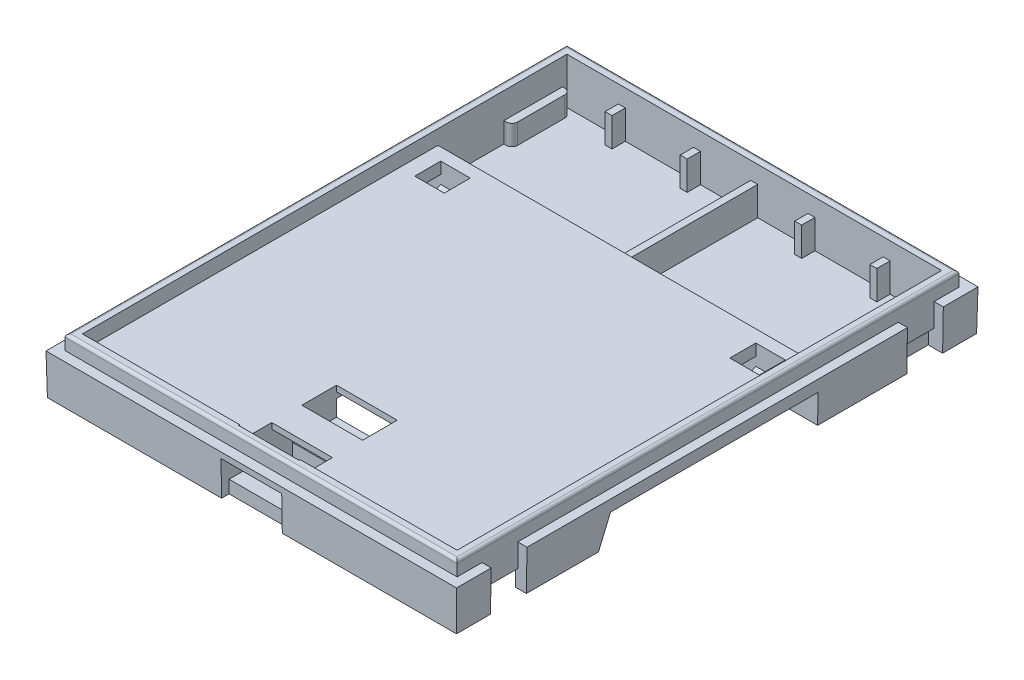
SolidWorks part; units mm, degrees
ref_plane "Спереди" through (0, 0, 0) normal (0, 0, 1) x (1, 0, 0)
ref_plane "Сверху" through (0, 0, 0) normal (0, 1, 0) x (1, 0, 0)
ref_plane "Справа" through (0, 0, 0) normal (1, 0, 0) x (0, 0, -1)
imported_body "Импортированный3"
sketch "Эскиз1" plane through (0, 0, 20.4222) normal (0, 0, -1) x (-1, 0, 0)
  line L0 (-33.5, -7) -> (33.5, -7)
  line L1 (33.5, -7) -> (33.5, -2)
  line L2 (33.5, -2) -> (-33.5, -2)
  line L3 (-33.5, -2) -> (-33.5, -7)
extrude "Вырез-Вытянуть1" cut sketch "Эскиз1" against normal blind 4.6778
sketch "Эскиз2" plane through (0, 0, 25.1) normal (0, 0, -1) x (-1, 0, 0)
  line L0 (7, -7) -> (33.5, -7)
  line L1 (33.5, -7) -> (33.5, -2)
  line L2 (33.5, -2) -> (7, -2)
  line L3 (7, -2) -> (7, -7)
extrude "Вырез-Вытянуть2" cut sketch "Эскиз2" against normal blind 14
sketch "Эскиз3" plane through (0, 0, 25.1) normal (0, 0, -1) x (-1, 0, 0)
  line L0 (-33.5, -2) -> (-33.5, -7)
  line L1 (-33.5, -7) -> (-7, -7)
  line L2 (-7, -7) -> (-7, -2)
  line L3 (-7, -2) -> (-33.5, -2)
extrude "Вырез-Вытянуть3" cut sketch "Эскиз3" against normal blind 14
ref_plane "Плоскость1" through (0, 0, 39.1) normal (0, 0, 1) x (1, 0, 0)
sketch "Эскиз4" plane through (0, 0, 39.1) normal (0, 0, 1) x (1, 0, 0)
  line L0 (-33.9, 0) -> (-35.5, 0)
  line L1 (-35.5, 0) -> (-35.3778, -7)
  line L2 (-35.3778, -7) -> (-33.5, -7)
  line L3 (-33.5, -7) -> (-33.5, -4)
  line L4 (-33.5, -4) -> (-33.9, -4)
  line L5 (-33.9, -4) -> (-33.9, 0)
extrude "Вырез-Вытянуть4" cut sketch "Эскиз4" against normal blind 6.2
sketch "Эскиз5" plane through (0, 0, 39.1) normal (0, 0, 1) x (1, 0, 0)
  line L0 (35.5, 0) -> (33.9, 0)
  line L1 (33.9, 0) -> (33.9, -4)
  line L2 (33.9, -4) -> (33.5, -4)
  line L3 (33.5, -4) -> (33.5, -7)
  line L4 (33.5, -7) -> (35.3778, -7)
  line L5 (35.3778, -7) -> (35.5, 0)
extrude "Вырез-Вытянуть5" cut sketch "Эскиз5" against normal blind 6.2
sketch "Эскиз6" plane through (35.3778, 0, 0) normal (1, 0, 0) x (0, 0, -1)
  line L0 (-45.0825, -7) -> (-44.9778, -7)
  line L1 (-44.9778, -7) -> (-45.0825, -1)
  line L2 (-45.0825, -1) -> (-45.0825, -7)
extrude "Вырез-Вытянуть6" cut sketch "Эскиз6" against normal blind 30.1278
sketch "Эскиз7" plane through (-35.3778, 0, 0) normal (-1, 0, 0) x (0, 0, 1)
  line L0 (45.0825, -7) -> (45.0825, -1)
  line L1 (45.0825, -1) -> (44.9778, -7)
  line L2 (44.9778, -7) -> (45.0825, -7)
extrude "Вырез-Вытянуть7" cut sketch "Эскиз7" against normal blind 30.1278
sketch "Эскиз8" plane through (0, 0, 45.0825) normal (0, 0, 1) x (1, 0, 0)
  line L0 (5.25, -7) -> (5.25, -1)
  line L1 (5.25, -1) -> (-5.25, -1)
  line L2 (-5.25, -1) -> (-5.25, -7)
  line L3 (-5.25, -7) -> (5.25, -7)
extrude "Вырез-Вытянуть8" cut sketch "Эскиз8" against normal blind 0.1047
ref_plane "Плоскость2" through (0, 0, -41.9) normal (0, 0, -1) x (-1, 0, 0)
sketch "Эскиз9" plane through (0, 0, -41.9) normal (0, 0, -1) x (-1, 0, 0)
  line L0 (-32.4, 0) -> (32.4, 0)
  line L1 (32.4, 0) -> (32.4, 2.5)
  line L2 (32.4, 2.5) -> (-32.4, 2.5)
  line L3 (-32.4, 2.5) -> (-32.4, 0)
extrude "Вырез-Вытянуть9" cut sketch "Эскиз9" against normal blind 83.8
sketch "Эскиз10" plane through (0, 0, 44.9778) normal (0, 0, 1) x (1, 0, 0)
  line L0 (5.25, -7) -> (5.25, -1)
  line L1 (5.25, -1) -> (-5.25, -1)
  line L2 (-5.25, -1) -> (-5.25, -7)
  line L3 (-5.25, -7) -> (5.25, -7)
extrude "Вырез-Вытянуть10" cut sketch "Эскиз10" against normal blind 3.0778
sketch "Эскиз11" plane through (0, 0, 41.9) normal (0, 0, -1) x (-1, 0, 0)
  line L0 (5.25, -1) -> (5.25, 2.5)
  line L1 (5.25, 2.5) -> (-5.25, 2.5)
  line L2 (-5.25, 2.5) -> (-5.25, -1)
  line L3 (-5.25, -1) -> (5.25, -1)
extrude "Вырез-Вытянуть11" cut sketch "Эскиз11" against normal blind 0.2
sketch "Эскиз12" plane through (0, 0, 41.9) normal (0, 0, 1) x (1, 0, 0)
  line L0 (-5.25, -2) -> (-5.25, -7)
  line L1 (-5.25, -7) -> (5.25, -7)
  line L2 (5.25, -7) -> (5.25, -2)
  line L3 (5.25, -2) -> (-5.25, -2)
extrude "Вырез-Вытянуть12" cut sketch "Эскиз12" against normal blind 9.2222
ref_plane "Плоскость3" through (0, -2, 0) normal (0, 1, 0) x (1, 0, 0)
sketch "Эскиз13" plane through (0, -2, 0) normal (0, 1, 0) x (1, 0, 0)
  line L0 (-5.25, -25.1) -> (-5.25, -32.6778)
  line L1 (-5.25, -32.6778) -> (5.25, -32.6778)
  line L2 (5.25, -32.6778) -> (5.25, -25.1)
  line L3 (5.25, -25.1) -> (-5.25, -25.1)
extrude "Вырез-Вытянуть13" cut sketch "Эскиз13" against normal blind 2.8
sketch "Эскиз14" plane through (0, 0, 41.9) normal (0, 0, 1) x (1, 0, 0)
  line L0 (5.25, -2) -> (5.25, 0)
  line L1 (5.25, 0) -> (-5.25, 0)
  line L2 (-5.25, 0) -> (-5.25, -2)
  line L3 (-5.25, -2) -> (5.25, -2)
extrude "Вырез-Вытянуть14" cut sketch "Эскиз14" against normal blind 16.8
ref_plane "Плоскость4" through (24.7, 0, 0) normal (-1, 0, 0) x (0, -1, 0)
sketch "Эскиз15" plane through (24.7, 0, 0) normal (-1, 0, 0) x (0, -1, 0)
  line L0 (2, -12.9778) -> (0, -12.9778)
  line L1 (0, -12.9778) -> (0, -17.4778)
  line L2 (0, -17.4778) -> (2, -17.4778)
  line L3 (2, -17.4778) -> (2, -12.9778)
extrude "Вырез-Вытянуть15" cut sketch "Эскиз15" against normal blind 5.1
ref_plane "Плоскость5" through (-24.7, 0, 0) normal (1, 0, 0) x (0, 0, -1)
sketch "Эскиз16" plane through (-24.7, 0, 0) normal (1, 0, 0) x (0, 0, -1)
  line L0 (17.4778, -2) -> (17.4778, 0)
  line L1 (17.4778, 0) -> (12.9778, 0)
  line L2 (12.9778, 0) -> (12.9778, -2)
  line L3 (12.9778, -2) -> (17.4778, -2)
extrude "Вырез-Вытянуть16" cut sketch "Эскиз16" against normal blind 5.1
sketch "Эскиз17" plane through (35.3778, 0, 0) normal (1, 0, 0) x (0, 0, -1)
  line L0 (14.7778, -7) -> (17.4778, -7)
  line L1 (17.4778, -7) -> (17.4778, -3.5)
  line L2 (17.4778, -3.5) -> (14.7778, -4.7)
  line L3 (14.7778, -4.7) -> (14.7778, -7)
extrude "Вырез-Вытянуть17" cut sketch "Эскиз17" against normal blind 5.5778
ref_plane "Плоскость6" through (-24.7, 0, 0) normal (-1, 0, 0) x (0, -1, 0)
sketch "Эскиз18" plane through (-24.7, 0, 0) normal (-1, 0, 0) x (0, -1, 0)
  line L0 (7, -17.4778) -> (7, -14.7778)
  line L1 (7, -14.7778) -> (4.7, -14.7778)
  line L2 (4.7, -14.7778) -> (3.5, -17.4778)
  line L3 (3.5, -17.4778) -> (7, -17.4778)
extrude "Вырез-Вытянуть18" cut sketch "Эскиз18" against normal blind 49.4
ref_plane "Плоскость7" through (0, 0, -32.9) normal (0, 0, 1) x (1, 0, 0)
sketch "Эскиз19" plane through (0, 0, -32.9) normal (0, 0, 1) x (1, 0, 0)
  line L0 (-35.3778, -7) -> (-33.9, -7)
  line L1 (-33.9, -7) -> (-33.9, 0)
  line L2 (-33.9, 0) -> (-35.5, 0)
  line L3 (-35.5, 0) -> (-35.3778, -7)
extrude "Вырез-Вытянуть19" cut sketch "Эскиз19" against normal blind 6.2
sketch "Эскиз20" plane through (0, 0, -32.9) normal (0, 0, 1) x (1, 0, 0)
  line L0 (33.9, 0) -> (33.9, -7)
  line L1 (33.9, -7) -> (35.3778, -7)
  line L2 (35.3778, -7) -> (35.5, 0)
  line L3 (35.5, 0) -> (33.9, 0)
extrude "Вырез-Вытянуть20" cut sketch "Эскиз20" against normal blind 6.2
sketch "Эскиз21" plane through (-35.3778, 0, 0) normal (-1, 0, 0) x (0, 0, 1)
  line L0 (-17.4778, -7) -> (-14.7778, -7)
  line L1 (-14.7778, -7) -> (-14.7778, -4.7)
  line L2 (-14.7778, -4.7) -> (-17.4778, -3.5)
  line L3 (-17.4778, -3.5) -> (-17.4778, -7)
extrude "Вырез-Вытянуть21" cut sketch "Эскиз21" against normal blind 5.5778
sketch "Эскиз22" plane through (0, 0, 0) normal (0, 1, 0) x (-1, 0, 0)
  line L0 (-32.4, -41.9) -> (32.4, -41.9)
  line L1 (32.4, -41.9) -> (32.4, -19.6)
  line L2 (32.4, -19.6) -> (-32.4, -19.6)
  line L3 (-32.4, -19.6) -> (-32.4, -41.9)
extrude "Вырез-Вытянуть22" cut sketch "Эскиз22" against normal blind 5.5
ref_plane "Плоскость8" through (33.9, 0, 0) normal (1, 0, 0) x (0, 0, -1)
ref_plane "Плоскость9" through (32.9, 0, 0) normal (-1, 0, 0) x (0, -1, 0)
sketch "Эскиз24" plane through (32.9, 0, 0) normal (-1, 0, 0) x (0, -1, 0)
  line L0 (4, -39.1) -> (7, -39.1)
  line L1 (7, -39.1) -> (7, -32.9)
  line L2 (7, -32.9) -> (4, -32.9)
  line L3 (4, -32.9) -> (4, -39.1)
extrude "Вырез-Вытянуть23" cut sketch "Эскиз24" against normal up to surface
ref_plane "Плоскость10" through (-33.9, 0, 0) normal (-1, 0, 0) x (0, -1, 0)
ref_plane "Плоскость11" through (-32.9, 0, 0) normal (1, 0, 0) x (0, 0, -1)
sketch "Эскиз26" plane through (-32.9, 0, 0) normal (1, 0, 0) x (0, 0, -1)
  line L0 (32.9, -4) -> (32.9, -7)
  line L1 (32.9, -7) -> (39.1, -7)
  line L2 (39.1, -7) -> (39.1, -4)
  line L3 (39.1, -4) -> (32.9, -4)
extrude "Вырез-Вытянуть24" cut sketch "Эскиз26" against normal up to surface
ref_plane "Плоскость12" through (0, 0, 41.9778) normal (0, 0, 1) x (1, 0, 0)
sketch "Эскиз27" plane through (0, 0, 41.9778) normal (0, 0, 1) x (1, 0, 0)
  line L0 (-33.5, -2) -> (-33.5, -7)
  line L1 (-33.5, -7) -> (-7, -7)
  line L2 (-7, -7) -> (-7, -2)
  line L3 (-7, -2) -> (-33.5, -2)
extrude "Вырез-Вытянуть25" cut sketch "Эскиз27" against normal up to next
sketch "Эскиз28" plane through (0, 0, 41.9778) normal (0, 0, 1) x (1, 0, 0)
  line L0 (7, -2) -> (7, -7)
  line L1 (7, -7) -> (33.5, -7)
  line L2 (33.5, -7) -> (33.5, -2)
  line L3 (33.5, -2) -> (7, -2)
extrude "Вырез-Вытянуть26" cut sketch "Эскиз28" against normal up to next
ref_plane "Плоскость13" through (0, -2, 0) normal (0, -1, 0) x (1, 0, 0)
ref_plane "Плоскость14" through (0, -1, 0) normal (0, 1, 0) x (1, 0, 0)
sketch "Эскиз30" plane through (0, -1, 0) normal (0, 1, 0) x (1, 0, 0)
  line L0 (-5.25, 5.2) -> (-5.25, -25.1)
  line L1 (-5.25, -25.1) -> (5.25, -25.1)
  line L2 (5.25, -25.1) -> (5.25, 5.2)
  line L3 (5.25, 5.2) -> (-5.25, 5.2)
extrude "Вырез-Вытянуть27" cut sketch "Эскиз30" against normal up to surface
sketch "Эскиз31" plane through (-5.25, 0, 0) normal (1, 0, 0) x (0, 0, -1)
  line L0 (-36.3, -1) -> (-36.3, 0)
  line L1 (-36.3, 0) -> (-31.1, 0)
  line L2 (-31.1, 0) -> (-31.1, -1)
  line L3 (-31.1, -1) -> (-36.3, -1)
extrude "Бобышка-Вытянуть1" add sketch "Эскиз31" along normal blind 10.5
sketch "Эскиз32" plane through (-5.25, 0, 0) normal (1, 0, 0) x (0, 0, -1)
  line L0 (-37.6778, -4.8) -> (-37.6778, -7)
  line L1 (-37.6778, -7) -> (-43.6778, -7)
  line L2 (-43.6778, -7) -> (-43.6778, -4.8)
  line L3 (-43.6778, -4.8) -> (-37.6778, -4.8)
extrude "Бобышка-Вытянуть2" add sketch "Эскиз32" along normal blind 10.5
sketch "Эскиз33" plane through (0, -2, 0) normal (0, -1, 0) x (1, 0, 0)
  line L0 (19.3234, -13.0778) -> (19.3234, -15.0778)
  line L1 (19.3234, -15.0778) -> (-13.0234, -15.0778)
  line L2 (-13.0234, -15.0778) -> (-13.0234, -13.0778)
  line L3 (-13.0234, -13.0778) -> (19.3234, -13.0778)
extrude "Бобышка-Вытянуть3" add sketch "Эскиз33" along normal blind 0.5
sketch "Эскиз34" plane through (0, -2, 0) normal (0, -1, 0) x (1, 0, 0)
  line L0 (-15.6666, 23.1) -> (-15.6666, 23.6)
  line L1 (-12.6666, 23.6) -> (-12.6666, 23.1)
  arc A0 (-12.6666, 23.1) -> (-15.6666, 23.1) centre (-14.1666, 23.1) cw
  arc A1 (-15.6666, 23.6) -> (-12.6666, 23.6) centre (-14.1666, 23.6) cw
extrude "Бобышка-Вытянуть4" add sketch "Эскиз34" along normal blind 3
sketch "Эскиз35" plane through (0, -2, 0) normal (0, -1, 0) x (1, 0, 0)
  line L0 (15.6666, 23.6) -> (15.6666, 23.1)
  line L1 (12.6666, 23.1) -> (12.6666, 23.6)
  arc A0 (15.6666, 23.1) -> (12.6666, 23.1) centre (14.1666, 23.1) cw
  arc A1 (12.6666, 23.6) -> (15.6666, 23.6) centre (14.1666, 23.6) cw
extrude "Бобышка-Вытянуть5" add sketch "Эскиз35" along normal blind 3
ref_plane "Плоскость15" through (0, 0, 0) normal (-1, 0, 0) x (0, -1, 0)
sketch "Эскиз36" plane through (0, 0, 0) normal (-1, 0, 0) x (0, -1, 0)
  line L0 (0.5, -19.6) -> (0.5, -41.9)
rib "Ребро1" sketch "Эскиз36" sketch "Эскиз36" thickness 1.2 extrusion direction parallel to sketch draft on no parameters "D1"=1.2
ref_plane "Плоскость16" through (0, 0, 36.0583) normal (0, 0, -1) x (-1, 0, 0)
sketch "Эскиз37" plane through (0, 0, 36.0583) normal (0, 0, -1) x (-1, 0, 0)
  line L0 (31.6423, -2) -> (31.6423, -4)
  line L1 (31.6423, -4) -> (33.5, -4)
rib "Ребро2" sketch "Эскиз37" sketch "Эскиз37" thickness 10.1356 extrusion direction parallel to sketch draft on no parameters "D1"=10.1356
sketch "Эскиз38" plane through (0, 0, 36.0583) normal (0, 0, -1) x (-1, 0, 0)
  line L0 (-31.6423, -4) -> (-31.6423, -2)
  line L1 (-33.5, -4) -> (-31.6423, -4)
rib "Ребро3" sketch "Эскиз38" sketch "Эскиз38" thickness 10.1356 extrusion direction parallel to sketch draft on no parameters "D1"=10.1356
ref_plane "Плоскость17" through (0, 0, -36.0583) normal (0, 0, -1) x (-1, 0, 0)
sketch "Эскиз39" plane through (0, 0, -36.0583) normal (0, 0, -1) x (-1, 0, 0)
  line L0 (-31.0087, -5.5) -> (-31.0087, -2)
  line L1 (-31.0087, -2) -> (-32.4, -2)
rib "Ребро4" sketch "Эскиз39" sketch "Эскиз39" thickness 10.1356 extrusion direction parallel to sketch draft on no parameters "D1"=10.1356
sketch "Эскиз40" plane through (0, 0, -36.0583) normal (0, 0, -1) x (-1, 0, 0)
  line L0 (32.4, -2) -> (31.0087, -2)
  line L1 (31.0087, -2) -> (31.0087, -5.5)
rib "Ребро5" sketch "Эскиз40" sketch "Эскиз40" thickness 10.1356 extrusion direction parallel to sketch draft on no parameters "D1"=10.1356
ref_plane "Плоскость18" through (-9.9, 0, 0) normal (-1, 0, 0) x (0, -1, 0)
sketch "Эскиз41" plane through (-9.9, 0, 0) normal (-1, 0, 0) x (0, -1, 0)
  line L0 (5.5, -39.6) -> (0.5, -39.6)
  line L1 (0.5, -39.6) -> (0.5, -41.9)
rib "Ребро6" sketch "Эскиз41" sketch "Эскиз41" thickness 1.2 extrusion direction parallel to sketch draft on no parameters "D1"=1.2
ref_plane "Плоскость19" through (9.9, 0, 0) normal (-1, 0, 0) x (0, -1, 0)
sketch "Эскиз42" plane through (9.9, 0, 0) normal (-1, 0, 0) x (0, -1, 0)
  line L0 (5.5, -39.6) -> (0.5, -39.6)
  line L1 (0.5, -39.6) -> (0.5, -41.9)
rib "Ребро7" sketch "Эскиз42" sketch "Эскиз42" thickness 1.2 extrusion direction parallel to sketch draft on no parameters "D1"=1.2
ref_plane "Плоскость20" through (22.9, 0, 0) normal (-1, 0, 0) x (0, -1, 0)
sketch "Эскиз43" plane through (22.9, 0, 0) normal (-1, 0, 0) x (0, -1, 0)
  line L0 (5.5, -39.6) -> (0.5, -39.6)
  line L1 (0.5, -39.6) -> (0.5, -41.9)
rib "Ребро8" sketch "Эскиз43" sketch "Эскиз43" thickness 1.2 extrusion direction parallel to sketch draft on no parameters "D1"=1.2
ref_plane "Плоскость21" through (-22.9, 0, 0) normal (-1, 0, 0) x (0, -1, 0)
sketch "Эскиз44" plane through (-22.9, 0, 0) normal (-1, 0, 0) x (0, -1, 0)
  line L0 (5.5, -39.6) -> (0.5, -39.6)
  line L1 (0.5, -39.6) -> (0.5, -41.9)
rib "Ребро9" sketch "Эскиз44" sketch "Эскиз44" thickness 1.2 extrusion direction parallel to sketch draft on no parameters "D1"=1.2
fillet "Скругление1" radius 0.5 4 edges at (0, 2.5, -43.4) (33.9, 2.5, 0) (-33.9, 2.5, 0) (0, 2.5, 43.4)
fillet "Скругление2" radius 1 8 edges at (-31.0087, -3.75, -30.9906) (31.6423, -3, 41.1261) (31.0087, -3.75, -30.9906) (31.6423, -3, 30.9906) (-31.0087, -3.75, -41.1261) (-31.6423, -3, 41.1261) (-31.6423, -3, 30.9906) (31.0087, -3.75, -41.1261)
